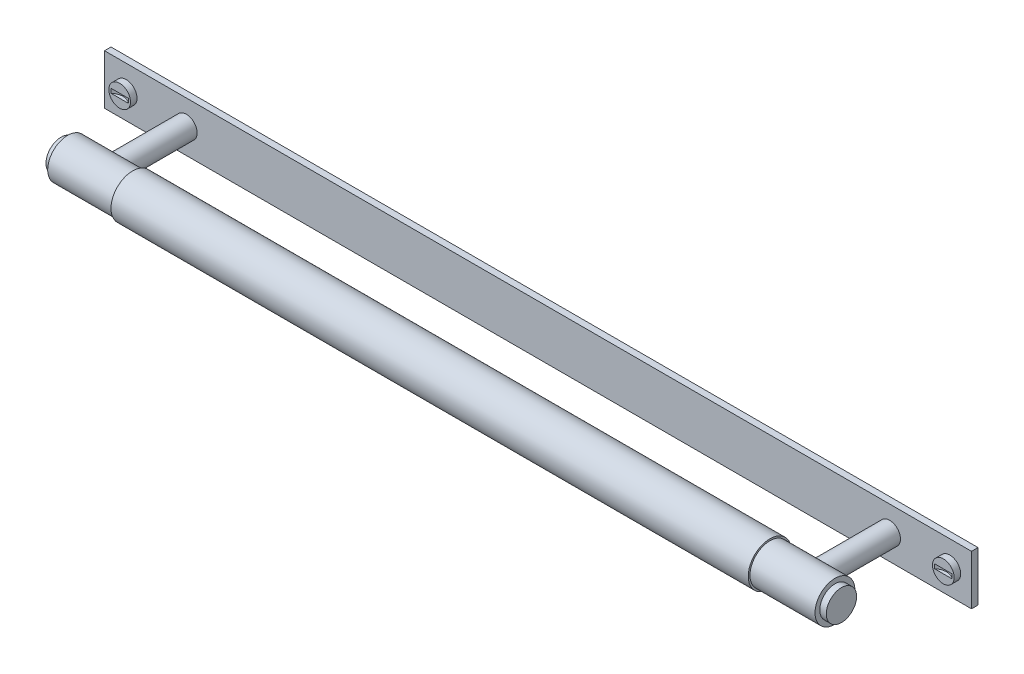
SolidWorks part; units mm, degrees
ref_plane "Front Plane" through (0, 0, 0) normal (0, 0, 1) x (1, 0, 0)
ref_plane "Top Plane" through (0, 0, 0) normal (0, 1, 0) x (1, 0, 0)
ref_plane "Right Plane" through (0, 0, 0) normal (1, 0, 0) x (0, 0, -1)
sketch "Sketch1" plane through (0, 0, 0) normal (1, 0, 0) x (0, 0, -1)
  circle A0 centre (0, 0) radius 10
  dimension "D1" = 20
extrude "Boss-Extrude1" add sketch "Sketch1" along normal blind 147
sketch "Sketch2" plane through (147, 0, 0) normal (1, 0, 0) x (0, 0, -1)
  circle A2 centre (0, 0) radius 9.2
  circle A3 centre (0, 0) radius 9.2
  dimension "D1" = 0.8
extrude "Boss-Extrude3" add sketch "Sketch2" along normal blind 30
sketch "Sketch3" plane through (177, 0, 0) normal (1, 0, 0) x (0, 0, -1)
  circle A0 centre (0, 0) radius 7
extrude "Boss-Extrude4" add sketch "Sketch3" along normal blind 3
mirror "Mirror1" about plane through (0, 0, 0) normal (1, 0, 0) of "Boss-Extrude4", "Boss-Extrude3", "Boss-Extrude1"
sketch "Sketch4" plane through (0, 0, 0) normal (0, 0, 1) x (1, 0, 0)
  line L0 (-180, 0) -> (-167.25, 0) construction
  line L1 (-180, 7) -> (-180, -7) construction
  line L2 (-167.25, 0) -> (-157.25, 0) construction
  line L3 (-162.25, 0) -> (-180, 0) construction
  circle A0 centre (-162.25, 0) radius 5
  dimension "D2" = 10
  dimension "D1" = 17.75
extrude "Boss-Extrude5" add sketch "Sketch4" against normal blind 40
mirror "Mirror2" about plane through (0, 0, 0) normal (1, 0, 0) of "Boss-Extrude5"
sketch "Sketch9" plane through (0, 0, 0) normal (1, 0, 0) x (0, 0, -1)
  line L2 (40, -11.5) -> (40, 11.5)
  line L3 (40, 11.5) -> (43, 11.5)
  line L4 (43, -11.5) -> (43, 11.5)
  line L5 (40, -11.5) -> (43, -11.5)
extrude "Boss-Extrude8" add sketch "Sketch9" along normal mid plane 400
sketch "Sketch10" plane through (0, 0, -40) normal (0, 0, 1) x (1, 0, 0)
  line L0 (0, 0) -> (190, 0) construction
  line L1 (200, 11.5) -> (200, -11.5) construction
  circle A0 centre (190, 0) radius 5
  point P4 (200, 0)
  dimension "D1" = 10
  dimension "D2" = 10
extrude "Boss-Extrude9" add sketch "Sketch10" along normal blind 3 contours A0
sketch "Sketch11" plane through (0, 0, 0) normal (0, 1, 0) x (1, 0, 0)
  line L0 (190, 37) -> (190, 38.5) construction
  line L1 (185, 37) -> (195, 37) construction
  line L2 (185, 37) -> (186, 37) construction
  line L3 (195, 37) -> (194, 37) construction
  line L6 (186, 37) -> (186, 34.6346)
  line L7 (186, 34.6346) -> (194, 34.6346)
  line L8 (194, 37) -> (194, 34.6346)
  arc A0 (186, 37) -> (194, 37) centre (190, 32.5279) cw
  dimension "D3" = 6
  dimension "D1" = 1
  dimension "D2" = 1
extrude "Cut-Extrude1" cut sketch "Sketch11" against normal mid plane 2
mirror "Mirror3" about plane through (0, 0, 0) normal (1, 0, 0) of "Cut-Extrude1", "Boss-Extrude9"
sketch "Sketch13" [suppressed] plane through (0, 0, -40) normal (0, 0, -1) x (-1, 0, 0)
  circle A0 centre (-362.25, 0) radius 12
  dimension "D1" = 24
extrude "Boss-Extrude10" [suppressed] add sketch "Sketch13" along normal blind 3
mirror "Mirror4" [suppressed] about plane through (0, 0, 0) normal (1, 0, 0)
